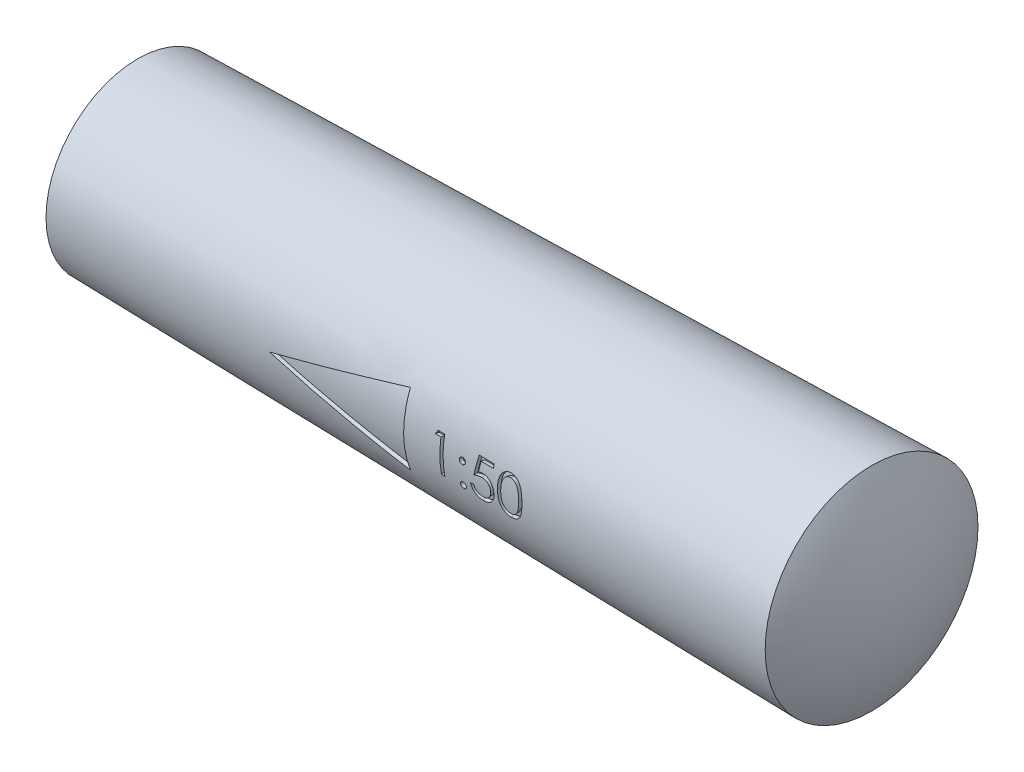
SolidWorks part; units mm, degrees
ref_plane "Front Plane" through (0, 0, 0) normal (0, 0, 1) x (1, 0, 0)
ref_plane "Top Plane" through (0, 0, 0) normal (0, 1, 0) x (1, 0, 0)
ref_plane "Right Plane" through (0, 0, 0) normal (1, 0, 0) x (0, 0, -1)
sketch "Sketch1" plane through (0, 0, 0) normal (1, 0, 0) x (0, 0, -1)
  circle A0 centre (0, 0) radius 2.5
  dimension "D1" = 5
extrude "Extrude1" add sketch "Sketch1" along normal mid plane 20
draft "Draft1" type of draft neutral plane draft angle 1.146 faces to draft 1 parameters "D1"=1.146
sketch "Sketch2" plane through (0, 0, 0) normal (0, 0, 1) x (1, 0, 0)
  line L0 (-10, 0) -> (-10, 2.5)
  line L1 (-10, 2.5) -> (-10, -2.5) construction
  line L2 (-10, 0) -> (-10.75, 0)
  line L3 (-10.75, 0) -> (-10.75, -2.7) construction
  line L4 (10, 0) -> (10, 2.9)
  line L5 (10, -2.9) -> (10, 2.9) construction
  line L6 (10, 0) -> (10.75, 0)
  line L7 (10.75, 0) -> (10.75, -2.7) construction
  line L8 (-10, -2.5) -> (10, -2.9) construction
  arc A0 (-10.75, 0) -> (-10, 2.5) centre (-6.2083, 0) cw
  arc A1 (10.75, 0) -> (10, 2.9) centre (4.7683, 0) ccw
  point P14 (0, -2.7)
revolve "Revolve1" add sketch "Sketch2" angle 360 about L2
sketch "Sketch5" plane through (0, 0, 0) normal (0, 0, 1) x (1, 0, 0)
  line L0 (0, 2.7) -> (0, -2.7) construction
  line L1 (10, 2.9) -> (-10, 2.5) construction
  line L2 (-10, -2.5) -> (10, -2.9) construction
ref_plane "Plane2" through (0, 0, 0) normal (-0.02, 0, 0.9998) x (0.9998, 0, 0.02)
sketch "Sketch6" plane through (0, 0, 0) normal (-0.02, 0, 0.9998) x (0.9998, 0, 0.02)
  line L0 (0, 0) -> (0, 1)
  line L1 (0, 2.7) -> (0, -2.7) construction
  line L2 (0, 1) -> (-3.7321, 0)
  line L3 (-3.7321, 0) -> (0, -1)
  line L4 (0, -1) -> (0, 0)
  line L5 (0, -0.5) -> (4, -0.5) construction
  text T0 "1:50" font "Century Gothic" height 1
  dimension "D1" = 2
  dimension "D2" = 30
  dimension "D3" = 4
wrap "Wrap2" sketch "Sketch6" wrap type deboss source sketch "Sketch6" thickness 0.1 parameters "D1"=0.1
equation "\"D2@Sketch2\" = \"D1@Sketch2\""
